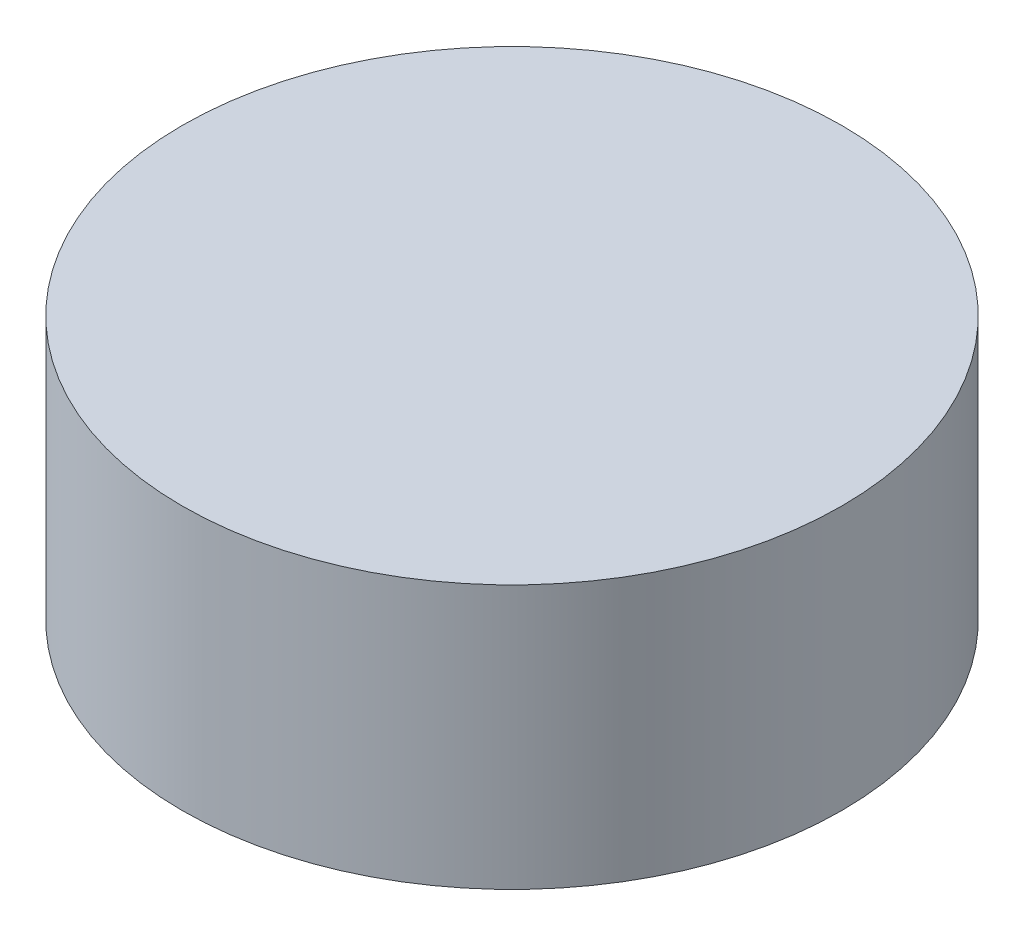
SolidWorks part; units mm, degrees
ref_plane "Front" through (0, 0, 0) normal (0, 0, 1) x (1, 0, 0)
ref_plane "Top" through (0, 0, 0) normal (0, 1, 0) x (1, 0, 0)
ref_plane "Right" through (0, 0, 0) normal (1, 0, 0) x (0, 0, -1)
sketch "Sketch1" plane through (0, 0, 0) normal (0, 1, 0) x (1, 0, 0)
  circle A0 centre (0, 0) radius 75
  dimension "D1" = 150
extrude "Extrude1" add sketch "Sketch1" along normal blind 60
ref_plane "Plane1" through (0, 100, 0) normal (0, 1, 0) x (-1, 0, 0)
ref_point "Point1"
